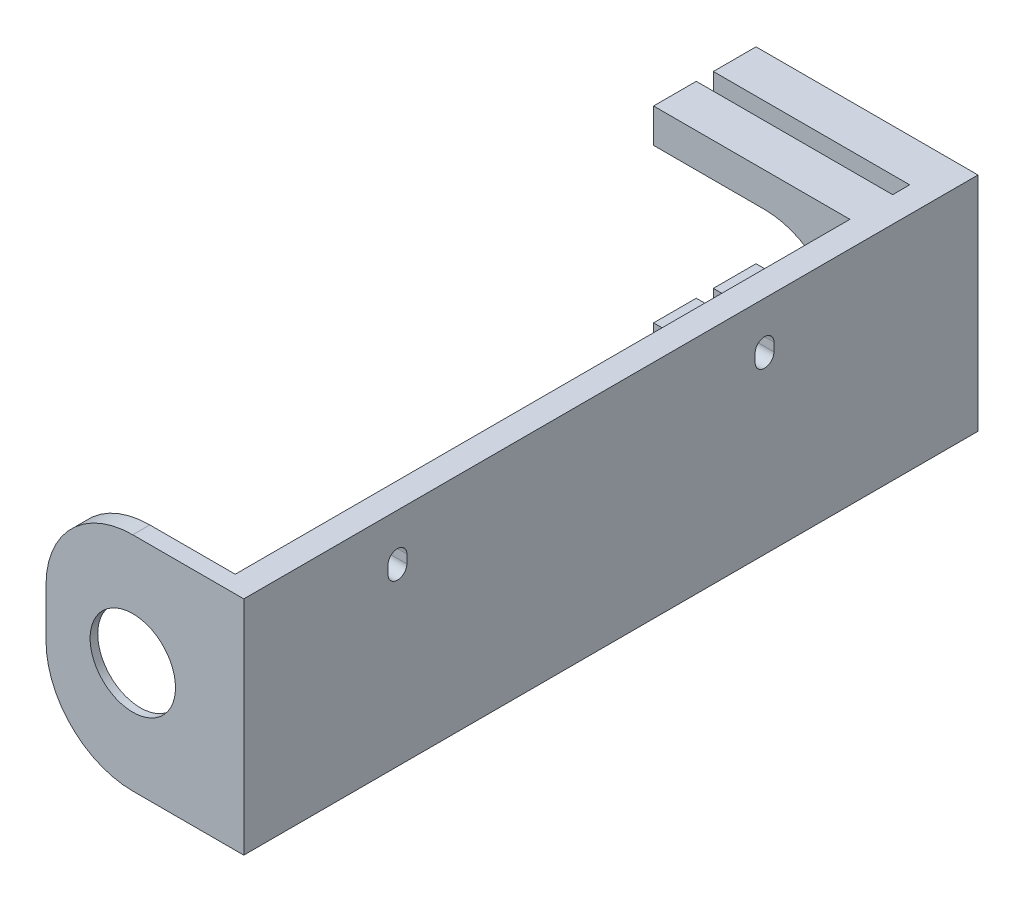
SolidWorks part; units mm, degrees
other "<needle-holder_up>-<SurfaceCut1>"
other "<needle-holder_down>-<Boss-Extrude15>"
ref_plane "Front Plane" through (0, 0, 0) normal (0, 0, 1) x (1, 0, 0)
ref_plane "Top Plane" through (0, 0, 0) normal (0, 1, 0) x (1, 0, 0)
ref_plane "Right Plane" through (0, 0, 0) normal (1, 0, 0) x (0, 0, -1)
ref_plane "前视基准面-needle-holder_up" through (-23.7853, -14.7077, 22.5434) normal (0, 0, 1) x (1, 0, 0)
ref_plane "上视基准面-needle-holder_up" through (-23.7853, -14.7077, 22.5434) normal (0, 1, 0) x (1, 0, 0)
ref_plane "右视基准面-needle-holder_up" through (-23.7853, -14.7077, 22.5434) normal (1, 0, 0) x (0, 0, -1)
sketch "草图1-needle-holder_up" plane through (-23.7853, -14.7077, 22.5434) normal (1, 0, 0) x (0, 0, -1)
  line L5 (0, 0) -> (28, 0)
  line L6 (0, 0) -> (0, 20)
  line L7 (0, 20) -> (28, 20)
  line L8 (28, 0) -> (28, 20)
  dimension "D1" = 28
  dimension "D2" = 20
ref_plane "前视基准面-needle-syringeholder-needle-holder_up" through (-51.5805, 52.3774, -5.4566) normal (0, -1, 0) x (1, 0, 0)
ref_plane "上视基准面-needle-syringeholder-needle-holder_up" through (-51.5805, 52.3774, -5.4566) normal (0, 0, 1) x (1, 0, 0)
ref_plane "右视基准面-needle-syringeholder-needle-holder_up" through (-51.5805, 52.3774, -5.4566) normal (1, 0, 0) x (0, 1, 0)
sketch "草图1-needle-syringeholder-needle-holder_up" plane through (-51.5805, 52.3774, -5.4566) normal (0, -1, 0) x (1, 0, 0)
  line L1 (0, 0) -> (20, 0)
  line L2 (0, 0) -> (0, -12)
  line L3 (0, -12) -> (20, -12)
  line L4 (20, 0) -> (20, -12)
  dimension "D1" = 20
  dimension "D2" = 12
sketch "草图2-needle-syringeholder-needle-holder_up" plane through (-51.5805, 52.3774, -5.4566) normal (-1, 0, 0) x (0, -1, 0)
  line L1 (4, -5) -> (25, -5)
  line L2 (4, -5) -> (4, -7)
  line L3 (4, -7) -> (25, -7)
  line L4 (25, -5) -> (25, -7)
  dimension "D1" = 2
  dimension "D2" = 21
sketch "草图3-needle-syringeholder-needle-holder_up" plane through (-51.5805, 52.3774, -17.4566) normal (0, 0, -1) x (-1, 0, 0)
  circle A0 centre (-10, -14.7) radius 8.7
  dimension "D1" = 17.4
sketch "草图4-needle-syringeholder-needle-holder_up" plane through (-51.5805, 52.3774, -17.4566) normal (0, 0, -1) x (1, 0, 0)
  line L1 (1.3, 14.7) -> (18.7, 14.7)
  line L2 (1.3, 14.7) -> (1.3, 25)
  line L3 (1.3, 25) -> (18.7, 25)
  line L4 (18.7, 14.7) -> (18.7, 25)
  dimension "D1" = 17.4
sketch "草图5-needle-syringeholder-needle-holder_up" plane through (-51.5805, 52.3774, -5.4566) normal (0, 0, 1) x (1, 0, 0)
  circle A0 centre (10, -14.7) radius 7.5
  dimension "D1" = 15
sketch "草图6-needle-syringeholder-needle-holder_up" plane through (-51.5805, 52.3774, -5.4566) normal (0, 0, 1) x (1, 0, 0)
  line L1 (2.5, -14.7) -> (17.5, -14.7)
  line L2 (2.5, -14.7) -> (2.5, -25)
  line L3 (2.5, -25) -> (17.5, -25)
  line L4 (17.5, -14.7) -> (17.5, -25)
  dimension "D1" = 15
sketch "Sketch8-needle-holder_up" plane through (-23.7853, -14.7077, -17.4566) normal (0, 0, -1) x (-1, 0, 0)
  line L0 (3, 10) -> (-3, 10)
  point P0 (3, 10)
sketch "Sketch9-needle-holder_up" plane through (-20.7853, -14.7077, 22.5434) normal (1, 0, 0) x (0, 0, -1)
  line L0 (40, 10) -> (0, 10)
  point P0 (40, 10)
sketch "Sketch11-needle-holder_up" plane through (-45.7853, -14.7077, 22.5434) normal (-1, 0, 0) x (0, 0, 1)
  line L16 (-35, 1.3) -> (-40, 1.3)
  line L17 (-40, 1.3) -> (-40, 0)
  line L18 (-40, 0) -> (-35, 0)
  line L19 (-35, 0) -> (-35, 1.3)
  line L20 (-28, 2.5) -> (-33, 2.5)
  line L21 (-33, 2.5) -> (-33, 0)
  line L22 (-33, 0) -> (-28, 0)
  line L23 (-28, 0) -> (-28, 2.5)
  line L24 (-33, 17.5) -> (-28, 17.5)
  line L25 (-28, 17.5) -> (-28, 20)
  line L26 (-28, 20) -> (-33, 20)
  line L27 (-33, 20) -> (-33, 17.5)
  line L28 (-40, 18.7) -> (-35, 18.7)
  line L29 (-35, 18.7) -> (-35, 20)
  line L30 (-35, 20) -> (-40, 20)
  line L31 (-40, 20) -> (-40, 18.7)
sketch "Sketch13-needle-holder_up" plane through (-23.7853, -14.7077, 22.5434) normal (0, -1, 0) x (1, 0, 0)
  line L0 (0, -28) -> (0, -40)
  line L3 (-1, -33) -> (0, -33)
  line L4 (-1, -33) -> (-1, -35)
  line L5 (-1, -35) -> (0, -35)
  line L6 (0, -33) -> (0, -35)
ref_plane "Plane1-needle-holder_up" through (-20.7853, 5.2923, 22.5434) normal (-1, 0, 0) x (0, 0, 1)
sketch "Sketch17-needle-holder_up" plane through (-23.7853, -14.7077, -5.4566) normal (0, 0, 1) x (1, 0, 0)
  line L2 (-10, 19) -> (-22, 19)
  line L3 (-10, 19) -> (-10, 1)
  line L4 (-10, 1) -> (-22, 1)
  line L5 (-22, 19) -> (-22, 1)
  circle A0 centre (-10, 10) radius 9
  dimension "D1" = 18
sketch "Sketch19-needle-holder_up" plane through (-23.7853, -14.7077, -5.4566) normal (0, 0, 1) x (1, 0, 0)
  line L1 (-22, 20) -> (0, 20)
  line L2 (-22, 20) -> (-22, 21)
  line L3 (-22, 21) -> (0, 21)
  line L4 (0, 20) -> (0, 21)
  line L5 (-22, 0) -> (0, 0)
  line L6 (-22, 0) -> (-22, -1)
  line L7 (-22, -1) -> (0, -1)
  line L8 (0, 0) -> (0, -1)
  line L11 (0, 0) -> (0, 20)
  line L13 (0, 21) -> (3, 21)
  line L14 (0, 21) -> (0, 20)
  line L15 (0, 20) -> (3, 20)
  line L16 (3, 21) -> (3, 20)
  line L17 (0, 0) -> (3, 0)
  line L18 (0, 0) -> (0, -1)
  line L19 (0, -1) -> (3, -1)
  line L20 (3, 0) -> (3, -1)
  dimension "D1" = 1
  dimension "D2" = 1
sketch "Sketch18-needle-holder_up" plane through (-23.7853, -14.7077, -5.4566) normal (0, 0, 1) x (1, 0, 0)
  line L1 (-21, 19) -> (-19, 19)
  line L2 (-21, 19) -> (-21, 1)
  line L3 (-21, 1) -> (-19, 1)
  line L4 (-19, 19) -> (-19, 1)
  line L6 (-21, 19) -> (-21.5, 20)
  line L7 (-21.5, 20) -> (-18.5, 20)
  line L8 (-18.5, 20) -> (-19, 19)
  line L9 (-3, 10) -> (-21, 10)
  line L10 (-18.5, 0) -> (-19, 1)
  line L11 (-21, 1) -> (-21.5, 0)
  line L12 (-21.5, 0) -> (-18.5, 0)
  dimension "D3" = 2
  dimension "D4" = 3
  dimension "D5" = 1
sketch "Sketch20-needle-holder_up" plane through (-45.7853, -14.7077, 22.5434) normal (-1, 0, 0) x (0, 0, 1)
  line L16 (-35, -1) -> (-35, 1)
  line L17 (-35, 1) -> (-40, 1)
  line L18 (-40, 1) -> (-40, -1)
  line L19 (-40, -1) -> (-35, -1)
  line L20 (-28, -1) -> (-28, 1)
  line L21 (-28, 1) -> (-33, 1)
  line L22 (-33, 1) -> (-33, -1)
  line L23 (-33, -1) -> (-28, -1)
  line L24 (-33, 19) -> (-28, 19)
  line L25 (-28, 19) -> (-28, 21)
  line L26 (-28, 21) -> (-33, 21)
  line L27 (-33, 21) -> (-33, 19)
  line L28 (-40, 19) -> (-35, 19)
  line L29 (-35, 19) -> (-35, 21)
  line L30 (-35, 21) -> (-40, 21)
  line L31 (-40, 21) -> (-40, 19)
sketch "Sketch23-needle-holder_up" plane through (-23.7853, -14.7077, 22.5434) normal (0, 0, 1) x (1, 0, 0)
  line L8 (0, 21) -> (0, -1)
  line L9 (0, -1) -> (3, -1)
  line L10 (3, -1) -> (3, 21)
  line L11 (3, 21) -> (0, 21)
sketch "Sketch28-needle-holder_up" plane through (-23.7853, -14.7077, 22.5434) normal (-1, 0, 0) x (0, 0, 1)
  line L1 (39, 21) -> (35, 21)
  line L2 (39, 21) -> (39, -1)
  line L3 (39, -1) -> (35, -1)
  line L4 (35, 21) -> (35, -1)
  dimension "D1" = 4
ref_plane "Front Plane-syringe10ml-cylinder-needle-holder_up" through (-33.7853, -4.7077, -62.8005) normal (-1, 0, 0) x (0, 0, 1)
ref_plane "Top Plane-syringe10ml-cylinder-needle-holder_up" through (-33.7853, -4.7077, -62.8005) normal (0, 1, 0) x (0, 0, 1)
ref_plane "Right Plane-syringe10ml-cylinder-needle-holder_up" through (-33.7853, -4.7077, -62.8005) normal (0, 0, 1) x (1, 0, 0)
sketch "Sketch1-syringe10ml-cylinder-needle-holder_up" plane through (-33.7853, -4.7077, -62.8005) normal (-1, 0, 0) x (0, 0, 1)
  line L0 (103.5215, 0) -> (-103.5215, 0) construction
  line L1 (0, 7.3) -> (0, 12)
  line L2 (0, 12) -> (1.8, 12)
  line L3 (1.8, 12) -> (1.8, 8.5)
  line L4 (1.8, 8.5) -> (71.75, 8.5)
  line L5 (71.75, 8.5) -> (73.2229, 4.7)
  line L10 (74.25, 2.05) -> (84, 2.05)
  line L11 (84, 2.05) -> (84, 0.95)
  line L12 (84, 0.95) -> (73.5388, 0.95)
  line L13 (73.5388, 0.95) -> (71, 7.5)
  line L14 (71, 7.5) -> (5, 7.5)
  line L15 (5, 7.5) -> (5, 7.3)
  line L16 (5, 7.3) -> (0, 7.3)
  line L17 (73.2229, 4.7) -> (81.2229, 4.7)
  line L18 (81.2229, 4.7) -> (81.2229, 3.5)
  line L19 (81.2229, 3.5) -> (73.688, 3.5)
  line L20 (73.688, 3.5) -> (74.25, 2.05)
  point P4 (0, 0)
  dimension "D1" = 24
  dimension "D2" = 17
  dimension "D3" = 15
  dimension "D4" = 14.6
  dimension "D5" = 5
  dimension "D6" = 1.8
  dimension "D7" = 84
  dimension "D8" = 9.75
  dimension "D9" = 71.75
  dimension "D10" = 111.186
  dimension "D11" = 9.4
  dimension "D12" = 4.1
  dimension "D13" = 1.9
  dimension "D14" = 7
  dimension "D15" = 71
  dimension "D16" = 8
sketch "Sketch9-syringe10ml-cylinder-needle-holder_up" plane through (-33.7853, -4.7077, -61.0005) normal (0, 0, 1) x (1, 0, 0)
  line L5 (1.25, -12) -> (1.75, -12)
  line L6 (-0.25, -12) -> (0.25, -12)
  line L2306 (-0.25, -12) -> (-0.25, 12)
  line L2307 (-0.25, 12) -> (0.25, 12)
  line L2308 (0.25, -12) -> (0.25, 12)
  line L2309 (-0.25, -12) -> (0.25, 12) construction
  line L2310 (-0.25, 12) -> (0.25, -12) construction
  line L2311 (1.75, -12) -> (1.75, 12)
  line L2312 (1.25, 12) -> (1.75, 12)
  line L2313 (1.25, -12) -> (1.25, 12)
  line L2314 (2.75, -12) -> (3.25, -12)
  line L2315 (3.25, -12) -> (3.25, 12)
  line L2316 (2.75, 12) -> (3.25, 12)
  line L2317 (2.75, -12) -> (2.75, 12)
  line L2318 (4.25, -12) -> (4.75, -12)
  line L2319 (4.75, -12) -> (4.75, 12)
  line L2320 (4.25, 12) -> (4.75, 12)
  line L2321 (4.25, -12) -> (4.25, 12)
  line L2322 (5.75, -12) -> (6.25, -12)
  line L2323 (6.25, -12) -> (6.25, 12)
  line L2324 (5.75, 12) -> (6.25, 12)
  line L2325 (5.75, -12) -> (5.75, 12)
  line L2326 (7.25, -12) -> (7.75, -12)
  line L2327 (7.75, -12) -> (7.75, 12)
  line L2328 (7.25, 12) -> (7.75, 12)
  line L2329 (7.25, -12) -> (7.25, 12)
  line L2330 (8.75, -12) -> (9.25, -12)
  line L2331 (9.25, -12) -> (9.25, 12)
  line L2332 (8.75, 12) -> (9.25, 12)
  line L2333 (8.75, -12) -> (8.75, 12)
  line L2334 (10.25, -12) -> (10.75, -12)
  line L2335 (10.75, -12) -> (10.75, 12)
  line L2336 (10.25, 12) -> (10.75, 12)
  line L2337 (10.25, -12) -> (10.25, 12)
  line L2338 (11.75, -12) -> (12.25, -12)
  line L2339 (12.25, -12) -> (12.25, 12)
  line L2340 (11.75, 12) -> (12.25, 12)
  line L2341 (11.75, -12) -> (11.75, 12)
  line L2342 (13.25, -12) -> (13.75, -12)
  line L2343 (13.75, -12) -> (13.75, 12)
  line L2344 (13.25, 12) -> (13.75, 12)
  line L2345 (13.25, -12) -> (13.25, 12)
  line L2346 (14.75, -12) -> (15.25, -12)
  line L2347 (15.25, -12) -> (15.25, 12)
  line L2348 (14.75, 12) -> (15.25, 12)
  line L2349 (14.75, -12) -> (14.75, 12)
  line L2350 (16.25, -12) -> (16.75, -12)
  line L2351 (16.75, -12) -> (16.75, 12)
  line L2352 (16.25, 12) -> (16.75, 12)
  line L2353 (16.25, -12) -> (16.25, 12)
  line L2354 (17.75, -12) -> (18.25, -12)
  line L2355 (18.25, -12) -> (18.25, 12)
  line L2356 (17.75, 12) -> (18.25, 12)
  line L2357 (17.75, -12) -> (17.75, 12)
  line L2358 (19.25, -12) -> (19.75, -12)
  line L2359 (19.75, -12) -> (19.75, 12)
  line L2360 (19.25, 12) -> (19.75, 12)
  line L2361 (19.25, -12) -> (19.25, 12)
  line L2362 (20.75, -12) -> (21.25, -12)
  line L2363 (21.25, -12) -> (21.25, 12)
  line L2364 (20.75, 12) -> (21.25, 12)
  line L2365 (20.75, -12) -> (20.75, 12)
  line L2366 (22.25, -12) -> (22.75, -12)
  line L2367 (22.75, -12) -> (22.75, 12)
  line L2368 (22.25, 12) -> (22.75, 12)
  line L2369 (22.25, -12) -> (22.25, 12)
  line L2370 (-1.75, -12) -> (-1.25, -12)
  line L2371 (-1.25, -12) -> (-1.25, 12)
  line L2372 (-1.75, 12) -> (-1.25, 12)
  line L2373 (-1.75, -12) -> (-1.75, 12)
  line L2374 (-3.25, -12) -> (-2.75, -12)
  line L2375 (-2.75, -12) -> (-2.75, 12)
  line L2376 (-3.25, 12) -> (-2.75, 12)
  line L2377 (-3.25, -12) -> (-3.25, 12)
  line L2378 (-4.75, -12) -> (-4.25, -12)
  line L2379 (-4.25, -12) -> (-4.25, 12)
  line L2380 (-4.75, 12) -> (-4.25, 12)
  line L2381 (-4.75, -12) -> (-4.75, 12)
  line L2382 (-6.25, -12) -> (-5.75, -12)
  line L2383 (-5.75, -12) -> (-5.75, 12)
  line L2384 (-6.25, 12) -> (-5.75, 12)
  line L2385 (-6.25, -12) -> (-6.25, 12)
  line L2386 (-7.75, -12) -> (-7.25, -12)
  line L2387 (-7.25, -12) -> (-7.25, 12)
  line L2388 (-7.75, 12) -> (-7.25, 12)
  line L2389 (-7.75, -12) -> (-7.75, 12)
  line L2390 (-9.25, -12) -> (-8.75, -12)
  line L2391 (-8.75, -12) -> (-8.75, 12)
  line L2392 (-9.25, 12) -> (-8.75, 12)
  line L2393 (-9.25, -12) -> (-9.25, 12)
  line L2394 (-10.75, -12) -> (-10.25, -12)
  line L2395 (-10.25, -12) -> (-10.25, 12)
  line L2396 (-10.75, 12) -> (-10.25, 12)
  line L2397 (-10.75, -12) -> (-10.75, 12)
  line L2398 (-12.25, -12) -> (-11.75, -12)
  line L2399 (-11.75, -12) -> (-11.75, 12)
  line L2400 (-12.25, 12) -> (-11.75, 12)
  line L2401 (-12.25, -12) -> (-12.25, 12)
  line L2402 (-13.75, -12) -> (-13.25, -12)
  line L2403 (-13.25, -12) -> (-13.25, 12)
  line L2404 (-13.75, 12) -> (-13.25, 12)
  line L2405 (-13.75, -12) -> (-13.75, 12)
  line L2406 (-15.25, -12) -> (-14.75, -12)
  line L2407 (-14.75, -12) -> (-14.75, 12)
  line L2408 (-15.25, 12) -> (-14.75, 12)
  line L2409 (-15.25, -12) -> (-15.25, 12)
  line L2410 (-16.75, -12) -> (-16.25, -12)
  line L2411 (-16.25, -12) -> (-16.25, 12)
  line L2412 (-16.75, 12) -> (-16.25, 12)
  line L2413 (-16.75, -12) -> (-16.75, 12)
  line L2414 (-18.25, -12) -> (-17.75, -12)
  line L2415 (-17.75, -12) -> (-17.75, 12)
  line L2416 (-18.25, 12) -> (-17.75, 12)
  line L2417 (-18.25, -12) -> (-18.25, 12)
  line L2418 (-19.75, -12) -> (-19.25, -12)
  line L2419 (-19.25, -12) -> (-19.25, 12)
  line L2420 (-19.75, 12) -> (-19.25, 12)
  line L2421 (-19.75, -12) -> (-19.75, 12)
  line L2422 (-21.25, -12) -> (-20.75, -12)
  line L2423 (-20.75, -12) -> (-20.75, 12)
  line L2424 (-21.25, 12) -> (-20.75, 12)
  line L2425 (-21.25, -12) -> (-21.25, 12)
  line L2426 (-22.75, -12) -> (-22.25, -12)
  line L2427 (-22.25, -12) -> (-22.25, 12)
  line L2428 (-22.75, 12) -> (-22.25, 12)
  line L2429 (-22.75, -12) -> (-22.75, 12)
  point P0 (0, 0)
  dimension "D1" = 0.5
  dimension "D2" = 16
  dimension "D3" = 16
sketch "Sketch7-syringe10ml-cylinder-needle-holder_up" plane through (-33.7853, -4.7077, -62.8005) normal (0, 0, -1) x (-1, 0, 0)
  line L0 (0, 22.4439) -> (0, -22.4439) construction
  line L1 (14.7478, 0) -> (-14.7478, 0) construction
  line L2 (-8.6269, -5.0574) -> (-5.9507, -9.6223)
  line L3 (-8.6269, 5.0574) -> (-5.9507, 9.6223)
  line L4 (8.6269, 5.0574) -> (5.9507, 9.6223)
  line L5 (8.6269, -5.0574) -> (5.9507, -9.6223)
  arc A1 (-3.75, -11.399) -> (3.75, -11.399) centre (0, 0) ccw
  arc A2 (8.6269, -5.0574) -> (8.6269, 5.0574) centre (0, 0) ccw
  arc A3 (-5.9507, -9.6223) -> (-3.75, -11.399) centre (-2.5, -7.5993) ccw
  arc A4 (-5.9507, 9.6223) -> (-3.75, 11.399) centre (-2.5, 7.5993) cw
  arc A5 (5.9507, 9.6223) -> (3.75, 11.399) centre (2.5, 7.5993) ccw
  arc A6 (5.9507, -9.6223) -> (3.75, -11.399) centre (2.5, -7.5993) cw
  arc A7 (3.75, 11.399) -> (-3.75, 11.399) centre (0, 0) ccw
  arc A8 (-8.6269, 5.0574) -> (-8.6269, -5.0574) centre (0, 0) ccw
  point P6 (0, 0)
  point P9 (0, 0)
  dimension "D1" = 4
  dimension "D2" = 5
  dimension "D3" = 10
sketch "Sketch8-syringe10ml-cylinder-needle-holder_up" plane through (-33.7853, -4.7077, -62.8005) normal (-1, 0, 0) x (0, 0, 1)
  line L0 (0, 0) -> (147.0884, 0) construction
  line L2 (70.75, 3) -> (71, 3)
  line L3 (70.75, 3) -> (70.75, -3)
  line L4 (70.75, -3) -> (71, -3)
  line L5 (71, 3) -> (71, -3)
  line L6 (70.75, 3) -> (71, -3) construction
  line L7 (70.75, -3) -> (71, 3) construction
  line L8 (59.45, 3) -> (59.45, -3)
  line L9 (59.45, -3) -> (59.7, -3)
  line L10 (59.7, 3) -> (59.7, -3)
  line L11 (59.45, 3) -> (59.7, 3)
  line L12 (48.15, 3) -> (48.15, -3)
  line L13 (48.15, -3) -> (48.4, -3)
  line L14 (48.4, 3) -> (48.4, -3)
  line L15 (48.15, 3) -> (48.4, 3)
  line L16 (36.85, 3) -> (36.85, -3)
  line L17 (36.85, -3) -> (37.1, -3)
  line L18 (37.1, 3) -> (37.1, -3)
  line L19 (36.85, 3) -> (37.1, 3)
  line L20 (25.55, 3) -> (25.55, -3)
  line L21 (25.55, -3) -> (25.8, -3)
  line L22 (25.8, 3) -> (25.8, -3)
  line L23 (25.55, 3) -> (25.8, 3)
  line L32 (66.23, 1.5) -> (66.23, -1.5)
  line L33 (68.49, 1.5) -> (68.74, 1.5)
  line L34 (68.49, 1.5) -> (68.49, -1.5)
  line L35 (68.49, -1.5) -> (68.74, -1.5)
  line L36 (68.74, 1.5) -> (68.74, -1.5)
  line L37 (68.49, 1.5) -> (68.74, -1.5) construction
  line L38 (68.49, -1.5) -> (68.74, 1.5) construction
  line L39 (66.23, -1.5) -> (66.48, -1.5)
  line L40 (66.48, 1.5) -> (66.48, -1.5)
  line L41 (66.23, 1.5) -> (66.48, 1.5)
  line L42 (63.97, 1.5) -> (63.97, -1.5)
  line L43 (63.97, -1.5) -> (64.22, -1.5)
  line L44 (64.22, 1.5) -> (64.22, -1.5)
  line L45 (63.97, 1.5) -> (64.22, 1.5)
  line L46 (61.71, 1.5) -> (61.71, -1.5)
  line L47 (61.71, -1.5) -> (61.96, -1.5)
  line L48 (61.96, 1.5) -> (61.96, -1.5)
  line L49 (61.71, 1.5) -> (61.96, 1.5)
  line L50 (59.45, 1.5) -> (59.45, -1.5)
  line L51 (59.45, -1.5) -> (59.7, -1.5)
  line L52 (59.7, 1.5) -> (59.7, -1.5)
  line L53 (59.45, 1.5) -> (59.7, 1.5)
  line L54 (57.19, 1.5) -> (57.19, -1.5)
  line L55 (57.19, -1.5) -> (57.44, -1.5)
  line L56 (57.44, 1.5) -> (57.44, -1.5)
  line L57 (57.19, 1.5) -> (57.44, 1.5)
  line L58 (54.93, 1.5) -> (54.93, -1.5)
  line L59 (54.93, -1.5) -> (55.18, -1.5)
  line L60 (55.18, 1.5) -> (55.18, -1.5)
  line L61 (54.93, 1.5) -> (55.18, 1.5)
  line L62 (52.67, 1.5) -> (52.67, -1.5)
  line L63 (52.67, -1.5) -> (52.92, -1.5)
  line L64 (52.92, 1.5) -> (52.92, -1.5)
  line L65 (52.67, 1.5) -> (52.92, 1.5)
  line L66 (50.41, 1.5) -> (50.41, -1.5)
  line L67 (50.41, -1.5) -> (50.66, -1.5)
  line L68 (50.66, 1.5) -> (50.66, -1.5)
  line L69 (50.41, 1.5) -> (50.66, 1.5)
  line L70 (48.15, 1.5) -> (48.15, -1.5)
  line L71 (48.15, -1.5) -> (48.4, -1.5)
  line L72 (48.4, 1.5) -> (48.4, -1.5)
  line L73 (48.15, 1.5) -> (48.4, 1.5)
  line L74 (45.89, 1.5) -> (45.89, -1.5)
  line L75 (45.89, -1.5) -> (46.14, -1.5)
  line L76 (46.14, 1.5) -> (46.14, -1.5)
  line L77 (45.89, 1.5) -> (46.14, 1.5)
  line L78 (43.63, 1.5) -> (43.63, -1.5)
  line L79 (43.63, -1.5) -> (43.88, -1.5)
  line L80 (43.88, 1.5) -> (43.88, -1.5)
  line L81 (43.63, 1.5) -> (43.88, 1.5)
  line L82 (41.37, 1.5) -> (41.37, -1.5)
  line L83 (41.37, -1.5) -> (41.62, -1.5)
  line L84 (41.62, 1.5) -> (41.62, -1.5)
  line L85 (41.37, 1.5) -> (41.62, 1.5)
  line L86 (39.11, 1.5) -> (39.11, -1.5)
  line L87 (39.11, -1.5) -> (39.36, -1.5)
  line L88 (39.36, 1.5) -> (39.36, -1.5)
  line L89 (39.11, 1.5) -> (39.36, 1.5)
  line L90 (36.85, 1.5) -> (36.85, -1.5)
  line L91 (36.85, -1.5) -> (37.1, -1.5)
  line L92 (37.1, 1.5) -> (37.1, -1.5)
  line L93 (36.85, 1.5) -> (37.1, 1.5)
  line L94 (34.59, 1.5) -> (34.59, -1.5)
  line L95 (34.59, -1.5) -> (34.84, -1.5)
  line L96 (34.84, 1.5) -> (34.84, -1.5)
  line L97 (34.59, 1.5) -> (34.84, 1.5)
  line L98 (32.33, 1.5) -> (32.33, -1.5)
  line L99 (32.33, -1.5) -> (32.58, -1.5)
  line L100 (32.58, 1.5) -> (32.58, -1.5)
  line L101 (32.33, 1.5) -> (32.58, 1.5)
  line L102 (30.07, 1.5) -> (30.07, -1.5)
  line L103 (30.07, -1.5) -> (30.32, -1.5)
  line L104 (30.32, 1.5) -> (30.32, -1.5)
  line L105 (30.07, 1.5) -> (30.32, 1.5)
  line L106 (27.81, 1.5) -> (27.81, -1.5)
  line L107 (27.81, -1.5) -> (28.06, -1.5)
  line L108 (28.06, 1.5) -> (28.06, -1.5)
  line L109 (27.81, 1.5) -> (28.06, 1.5)
  line L110 (25.55, 1.5) -> (25.55, -1.5)
  line L111 (25.55, -1.5) -> (25.8, -1.5)
  line L112 (25.8, 1.5) -> (25.8, -1.5)
  line L113 (25.55, 1.5) -> (25.8, 1.5)
  line L130 (13, -3) -> (13, -8) construction
  line L131 (23.29, 1.5) -> (23.29, -1.5)
  line L132 (23.29, -1.5) -> (23.54, -1.5)
  line L133 (23.54, 1.5) -> (23.54, -1.5)
  line L150 (23.29, 1.5) -> (23.54, 1.5)
  line L151 (21.03, 1.5) -> (21.03, -1.5)
  line L152 (21.03, -1.5) -> (21.28, -1.5)
  line L153 (21.28, 1.5) -> (21.28, -1.5)
  line L154 (58.2, 3) -> (58.2, 8) construction
  line L155 (46.9, 3) -> (46.9, 8) construction
  line L156 (35.6, 3) -> (35.6, 8) construction
  line L157 (24.3, 3) -> (24.3, 8) construction
  line L158 (21.03, 1.5) -> (21.28, 1.5)
  line L159 (18.77, 1.5) -> (18.77, -1.5)
  line L160 (18.77, -1.5) -> (19.02, -1.5)
  line L161 (19.02, 1.5) -> (19.02, -1.5)
  line L162 (18.77, 1.5) -> (19.02, 1.5)
  line L163 (16.51, 1.5) -> (16.51, -1.5)
  line L164 (16.51, -1.5) -> (16.76, -1.5)
  line L165 (16.76, 1.5) -> (16.76, -1.5)
  line L166 (16.51, 1.5) -> (16.76, 1.5)
  line L171 (13, 3) -> (13, 8) construction
  line L172 (14.25, 3) -> (14.25, -3)
  line L173 (14.25, -3) -> (14.5, -3)
  line L174 (14.5, 3) -> (14.5, -3)
  line L175 (14.25, 3) -> (14.5, 3)
  line L176 (14.25, 1.5) -> (14.5, 1.5)
  line L177 (14.25, 1.5) -> (14.25, -1.5)
  line L178 (14.25, -1.5) -> (14.5, -1.5)
  line L179 (14.5, 1.5) -> (14.5, -1.5)
  text T0 "2" font "Century Gothic" height 2.5
  text T1 "4" font "Century Gothic" height 2.5
  text T2 "6" font "Century Gothic" height 2.5
  text T3 "8" font "Century Gothic" height 2.5
  text T4 "ml" font "Century Gothic" height 2.5
  text T5 "10" font "Century Gothic" height 2.5
  point P3 (70.875, 0)
  point P10 (68.615, 0)
  dimension "D1" = 0.25
  dimension "D2" = 6
  dimension "D4" = 3
  dimension "D5" = 2.26
  dimension "D7" = 2.26
  dimension "D8" = 11.3
  dimension "D9" = 5
  dimension "D11" = 1.5
  dimension "D12" = 1.5
  dimension "D3" = 6
  dimension "D6" = 25
  dimension "D10" = 5
sketch "Sketch34-needle-holder_up" plane through (-23.7853, -14.7077, 57.5434) normal (0, 0, -1) x (-1, 0, 0)
  circle A0 centre (10, 10) radius 8.75
  dimension "D1" = 17.5
sketch "Sketch35-needle-holder_up" plane through (-23.7853, -14.7077, 57.5434) normal (0, 0, -1) x (-1, 0, 0)
  circle A0 centre (10, 10) radius 5
  dimension "D1" = 10
sketch "Sketch21-needle-holder_up" plane through (-20.7853, -14.7077, 22.5434) normal (1, 0, 0) x (0, 0, -1)
  line L0 (0.5, 21) -> (0.5, -1) construction
  line L2 (-21, 18) -> (-21, 17) construction
  line L12 (-19.9, 18) -> (-19.9, 17)
  line L15 (-22.1, 18) -> (-22.1, 17)
  line L16 (22, 18) -> (22, 17) construction
  line L17 (20.9, 18) -> (20.9, 17)
  line L18 (23.1, 18) -> (23.1, 17)
  arc A10 (-19.9, 18) -> (-22.1, 18) centre (-21, 18) ccw
  arc A11 (-22.1, 17) -> (-19.9, 17) centre (-21, 17) ccw
  arc A12 (20.9, 18) -> (23.1, 18) centre (22, 18) cw
  arc A13 (23.1, 17) -> (20.9, 17) centre (22, 17) cw
  point P4 (-21, 17.5)
  point P12 (22, 17.5)
  dimension "D1" = 1.1
  dimension "D2" = 1
sketch "Sketch36-needle-holder_up" plane through (-23.7853, -14.7077, 22.5434) normal (-1, 0, 0) x (0, 0, 1)
  circle A0 centre (6.6018, 6.2809) radius 1.6
  dimension "D1" = 3.2
sketch "Sketch37-needle-holder_up" plane through (-20.7853, -14.7077, 22.5434) normal (1, 0, 0) x (0, 0, -1)
  line L1 (-37, 1.25) -> (-37, 18.75)
  line L2 (-37, 18.75) -> (-37, 21)
  line L4 (-37, 21) -> (-28, 21)
  line L5 (-28, 21) -> (-28, -1)
  line L7 (-28, -1) -> (-37, -1)
  line L8 (-37, -1) -> (-37, 1.25)
  dimension "D1" = 9
sketch "Sketch39-needle-holder_up" plane through (-23.7853, -14.7077, 22.5434) normal (-1, 0, 0) x (0, 0, 1)
  line L1 (-23.0764, 8.0309) -> (31.9236, 8.0309)
  line L2 (-23.0764, 8.0309) -> (-23.0764, 4.5309)
  line L3 (-23.0764, 4.5309) -> (31.9236, 4.5309)
  line L4 (31.9236, 8.0309) -> (31.9236, 4.5309)
  point P4 (6.6018, 6.2809)
  point P5 (-23.0764, 6.2809)
  dimension "D1" = 55
  dimension "D2" = 3.5
sketch "Sketch40-needle-holder_up" plane through (-23.7853, -15.7077, 22.5434) normal (0, -1, 0) x (1, 0, 0)
  line L24 (-10, 39) -> (-10, 37)
  line L25 (-10, 37) -> (0, 37)
  line L26 (0, 37) -> (0, -28)
  line L27 (0, -28) -> (-23, -28)
  line L28 (-23, -28) -> (-23, -33)
  line L29 (-23, -33) -> (0, -33)
  line L30 (0, -33) -> (0, -35)
  line L31 (0, -35) -> (-23, -35)
  line L32 (-23, -35) -> (-23, -40)
  line L33 (-23, -40) -> (3, -40)
  line L34 (3, -40) -> (3, 39)
  line L35 (3, 39) -> (-10, 39)
sketch "Sketch42-needle-holder_up" plane through (-23.7853, -14.7077, 61.5434) normal (0, 0, 1) x (1, 0, 0)
  line L0 (-20.1667, 7.1667) -> (-20.1667, 12.8333)
  line L12 (-20, 11) -> (-20, 9)
  line L13 (-10, -1) -> (-10, -3)
  line L14 (-10, -3) -> (3, -3)
  line L15 (3, -3) -> (3, 23)
  line L16 (3, 23) -> (-10, 23)
  line L17 (-10, 23) -> (-10, 21)
  arc A0 (-10, 23) -> (-20, 11) centre (-10, 12.8333) ccw
  arc A1 (-10, -3) -> (-20, 9) centre (-10, 7.1667) cw
  arc A4 (-20, 9) -> (-10, -1) centre (-10, 9) ccw
  arc A5 (-10, 21) -> (-20, 11) centre (-10, 11) ccw
ref_plane "Plane2-needle-holder_up" through (-23.7853, -14.7077, -5.4566) normal (0, 0, 1) x (1, 0, 0)
inserted part "needle-holder_up" parameters "D1.凸台-拉伸2"=3, "D1.草图1"=28, "D2.草图1"=20, "D1.凸台-拉伸1.needle-syringeholder"=25, "D1.草图1.needle-syringeholder"=20, "D2.草图1.needle-syringeholder"=12, "D1.草图2.needle-syringeholder"=2, "D2.草图2.needle-syringeholder"=21, "D3.草图2.needle-syringeholder"=5, "D1.草图3.needle-syringeholder"=17.4, "D2.草图3.needle-syringeholder"=10.3, "D3.草图3.needle-syringeholder"=10, "D1.草图4.needle-syringeholder"=17.4, "D1.草图5.needle-syringeholder"=15, "D2.草图5.needle-syringeholder"=10.3, "D3.草图5.needle-syringeholder"=10, "D1.草图6.needle-syringeholder"=15, "D1.Sketch17"=18, "D2.Sketch17"=10, "D1.Sketch19"=1, "D2.Sketch19"=1, "D1.Boss-Extrude4"=1, "D1.Boss-Extrude5"=39, "D1.Sketch23"=0, "D1.Boss-Extrude11"=20, "D1.Sketch28"=4, "D1.Revolve1.syringe10ml-cylinder"=360, "D5.Sketch1.syringe10ml-cylinder"=5, "D6.Sketch1.syringe10ml-cylinder"=1.8, "D7.Sketch1.syringe10ml-cylinder"=84, "D9.Sketch1.syringe10ml-cylinder"=71.75, "D15.Sketch1.syringe10ml-cylinder"=71, "D1.Sketch1.syringe10ml-cylinder"=24, "D2.Sketch1.syringe10ml-cylinder"=17, "D3.Sketch1.syringe10ml-cylinder"=15, "D4.Sketch1.syringe10ml-cylinder"=14.6, "D12.Sketch1.syringe10ml-cylinder"=4.1, "D13.Sketch1.syringe10ml-cylinder"=1.9, "D8.Sketch1.syringe10ml-cylinder"=9.75, "D10.Sketch1.syringe10ml-cylinder"=111.186, "D16.Sketch1.syringe10ml-cylinder"=8, "D11.Sketch1.syringe10ml-cylinder"=9.4, "D14.Sketch1.syringe10ml-cylinder"=7, "D1.Cut-Extrude2.syringe10ml-cylinder"=0.1, "D1.Sketch9.syringe10ml-cylinder"=0.5, "D2.Sketch9.syringe10ml-cylinder"=16, "D3.Sketch9.syringe10ml-cylinder"=16, "D1.Sketch7.syringe10ml-cylinder"=4, "D2.Sketch7.syringe10ml-cylinder"=5, "D3.Sketch7.syringe10ml-cylinder"=10, "D1.Fillet1.syringe10ml-cylinder"=5, "D1.Wrap1.syringe10ml-cylinder"=0.01, "D1.Sketch8.syringe10ml-cylinder"=0.25, "D2.Sketch8.syringe10ml-cylinder"=6, "D3.Sketch8.syringe10ml-cylinder"=6, "D4.Sketch8.syringe10ml-cylinder"=3, "D5.Sketch8.syringe10ml-cylinder"=2.26, "D6.Sketch8.syringe10ml-cylinder"=25, "D7.Sketch8.syringe10ml-cylinder"=2.26, "D8.Sketch8.syringe10ml-cylinder"=11.3, "D9.Sketch8.syringe10ml-cylinder"=5, "D10.Sketch8.syringe10ml-cylinder"=5, "D11.Sketch8.syringe10ml-cylinder"=1.5, "D12.Sketch8.syringe10ml-cylinder"=1.5, "D8.Thread1.syringe10ml-cylinder"=0, "D7.Thread1.syringe10ml-cylinder"=2, "D6.Thread1.syringe10ml-cylinder"=7, "D4.Thread1.syringe10ml-cylinder"=7, "D1.Thread1.syringe10ml-cylinder"=0, "Pitch.Thread Profile1.syringe10ml-cylinder"=1.25, "Profile_Land.Thread Profile1.syringe10ml-cylinder"=0.3125, "Profile_Angle.Thread Profile1.syringe10ml-cylinder"=60, "Profile_Height.Thread Profile1.syringe10ml-cylinder"=0.6766, "D1.Cut-Extrude10"=2, "D1.Sketch34"=17.5, "D1.Cut-Extrude11"=25, "D1.Sketch35"=10, "D1.Cut-Extrude7"=10, "D1.Sketch21"=1.1, "D2.Sketch21"=1, "D1.Fillet1"=10, "D1.Fillet2"=10, "D1.Sketch36"=3.2, "D1.Sketch37"=9, "D1.Boss-Extrude12"=2, "D1.Sketch40"=0, "D1.Boss-Extrude13"=2, "D1.Sketch42"=0
ref_plane "前视基准面-needle-holder_down" through (-82.9443, 5.8429, 37.0413) normal (0, 0, 1) x (1, 0, 0)
ref_plane "上视基准面-needle-holder_down" through (-82.9443, 5.8429, 37.0413) normal (0, 1, 0) x (1, 0, 0)
ref_plane "右视基准面-needle-holder_down" through (-82.9443, 5.8429, 37.0413) normal (1, 0, 0) x (0, 0, -1)
sketch "草图1-needle-holder_down" plane through (-82.9443, 5.8429, 37.0413) normal (1, 0, 0) x (0, 0, -1)
  line L5 (0, 0) -> (28, 0)
  line L6 (0, 0) -> (0, 20)
  line L7 (0, 20) -> (28, 20)
  line L8 (28, 0) -> (28, 20)
  dimension "D1" = 28
  dimension "D2" = 20
ref_plane "前视基准面-needle-syringeholder-needle-holder_down" through (-110.7395, 72.928, 9.0413) normal (0, -1, 0) x (1, 0, 0)
ref_plane "上视基准面-needle-syringeholder-needle-holder_down" through (-110.7395, 72.928, 9.0413) normal (0, 0, 1) x (1, 0, 0)
ref_plane "右视基准面-needle-syringeholder-needle-holder_down" through (-110.7395, 72.928, 9.0413) normal (1, 0, 0) x (0, 1, 0)
sketch "草图1-needle-syringeholder-needle-holder_down" plane through (-110.7395, 72.928, 9.0413) normal (0, -1, 0) x (1, 0, 0)
  line L1 (0, 0) -> (20, 0)
  line L2 (0, 0) -> (0, -12)
  line L3 (0, -12) -> (20, -12)
  line L4 (20, 0) -> (20, -12)
  dimension "D1" = 20
  dimension "D2" = 12
sketch "草图2-needle-syringeholder-needle-holder_down" plane through (-110.7395, 72.928, 9.0413) normal (-1, 0, 0) x (0, -1, 0)
  line L1 (4, -5) -> (25, -5)
  line L2 (4, -5) -> (4, -7)
  line L3 (4, -7) -> (25, -7)
  line L4 (25, -5) -> (25, -7)
  dimension "D1" = 2
  dimension "D2" = 21
sketch "草图3-needle-syringeholder-needle-holder_down" plane through (-110.7395, 72.928, -2.9587) normal (0, 0, -1) x (-1, 0, 0)
  circle A0 centre (-10, -14.7) radius 8.7
  dimension "D1" = 17.4
sketch "草图4-needle-syringeholder-needle-holder_down" plane through (-110.7395, 72.928, -2.9587) normal (0, 0, -1) x (1, 0, 0)
  line L1 (1.3, 14.7) -> (18.7, 14.7)
  line L2 (1.3, 14.7) -> (1.3, 25)
  line L3 (1.3, 25) -> (18.7, 25)
  line L4 (18.7, 14.7) -> (18.7, 25)
  dimension "D1" = 17.4
sketch "草图5-needle-syringeholder-needle-holder_down" plane through (-110.7395, 72.928, 9.0413) normal (0, 0, 1) x (1, 0, 0)
  circle A0 centre (10, -14.7) radius 7.5
  dimension "D1" = 15
sketch "草图6-needle-syringeholder-needle-holder_down" plane through (-110.7395, 72.928, 9.0413) normal (0, 0, 1) x (1, 0, 0)
  line L1 (2.5, -14.7) -> (17.5, -14.7)
  line L2 (2.5, -14.7) -> (2.5, -25)
  line L3 (2.5, -25) -> (17.5, -25)
  line L4 (17.5, -14.7) -> (17.5, -25)
  dimension "D1" = 15
sketch "Sketch8-needle-holder_down" plane through (-82.9443, 5.8429, -2.9587) normal (0, 0, -1) x (-1, 0, 0)
  line L0 (3, 10) -> (-3, 10)
  point P0 (3, 10)
sketch "Sketch9-needle-holder_down" plane through (-79.9443, 5.8429, 37.0413) normal (1, 0, 0) x (0, 0, -1)
  line L0 (40, 10) -> (0, 10)
  point P0 (40, 10)
sketch "Sketch11-needle-holder_down" plane through (-104.9443, 5.8429, 37.0413) normal (-1, 0, 0) x (0, 0, 1)
  line L16 (-35, 1.3) -> (-40, 1.3)
  line L17 (-40, 1.3) -> (-40, 0)
  line L18 (-40, 0) -> (-35, 0)
  line L19 (-35, 0) -> (-35, 1.3)
  line L20 (-28, 2.5) -> (-33, 2.5)
  line L21 (-33, 2.5) -> (-33, 0)
  line L22 (-33, 0) -> (-28, 0)
  line L23 (-28, 0) -> (-28, 2.5)
  line L24 (-33, 17.5) -> (-28, 17.5)
  line L25 (-28, 17.5) -> (-28, 20)
  line L26 (-28, 20) -> (-33, 20)
  line L27 (-33, 20) -> (-33, 17.5)
  line L28 (-40, 18.7) -> (-35, 18.7)
  line L29 (-35, 18.7) -> (-35, 20)
  line L30 (-35, 20) -> (-40, 20)
  line L31 (-40, 20) -> (-40, 18.7)
sketch "Sketch13-needle-holder_down" plane through (-82.9443, 5.8429, 37.0413) normal (0, -1, 0) x (1, 0, 0)
  line L0 (0, -28) -> (0, -40)
  line L3 (-1, -33) -> (0, -33)
  line L4 (-1, -33) -> (-1, -35)
  line L5 (-1, -35) -> (0, -35)
  line L6 (0, -33) -> (0, -35)
ref_plane "Plane1-needle-holder_down" through (-79.9443, 25.8429, 37.0413) normal (-1, 0, 0) x (0, 0, 1)
sketch "Sketch17-needle-holder_down" plane through (-82.9443, 5.8429, 9.0413) normal (0, 0, 1) x (1, 0, 0)
  line L2 (-10, 19) -> (-22, 19)
  line L3 (-10, 19) -> (-10, 1)
  line L4 (-10, 1) -> (-22, 1)
  line L5 (-22, 19) -> (-22, 1)
  circle A0 centre (-10, 10) radius 9
  dimension "D1" = 18
sketch "Sketch19-needle-holder_down" plane through (-82.9443, 5.8429, 9.0413) normal (0, 0, 1) x (1, 0, 0)
  line L1 (-22, 20) -> (0, 20)
  line L2 (-22, 20) -> (-22, 21)
  line L3 (-22, 21) -> (0, 21)
  line L4 (0, 20) -> (0, 21)
  line L5 (-22, 0) -> (0, 0)
  line L6 (-22, 0) -> (-22, -1)
  line L7 (-22, -1) -> (0, -1)
  line L8 (0, 0) -> (0, -1)
  line L11 (0, 0) -> (0, 20)
  line L13 (0, 21) -> (3, 21)
  line L14 (0, 21) -> (0, 20)
  line L15 (0, 20) -> (3, 20)
  line L16 (3, 21) -> (3, 20)
  line L17 (0, 0) -> (3, 0)
  line L18 (0, 0) -> (0, -1)
  line L19 (0, -1) -> (3, -1)
  line L20 (3, 0) -> (3, -1)
  dimension "D1" = 1
  dimension "D2" = 1
sketch "Sketch18-needle-holder_down" plane through (-82.9443, 5.8429, 9.0413) normal (0, 0, 1) x (1, 0, 0)
  line L1 (-21, 19) -> (-19, 19)
  line L2 (-21, 19) -> (-21, 1)
  line L3 (-21, 1) -> (-19, 1)
  line L4 (-19, 19) -> (-19, 1)
  line L6 (-21, 19) -> (-21.5, 20)
  line L7 (-21.5, 20) -> (-18.5, 20)
  line L8 (-18.5, 20) -> (-19, 19)
  line L9 (-3, 10) -> (-21, 10)
  line L10 (-18.5, 0) -> (-19, 1)
  line L11 (-21, 1) -> (-21.5, 0)
  line L12 (-21.5, 0) -> (-18.5, 0)
  dimension "D3" = 2
  dimension "D4" = 3
  dimension "D5" = 1
sketch "Sketch20-needle-holder_down" plane through (-104.9443, 5.8429, 37.0413) normal (-1, 0, 0) x (0, 0, 1)
  line L16 (-35, -1) -> (-35, 1)
  line L17 (-35, 1) -> (-40, 1)
  line L18 (-40, 1) -> (-40, -1)
  line L19 (-40, -1) -> (-35, -1)
  line L20 (-28, -1) -> (-28, 1)
  line L21 (-28, 1) -> (-33, 1)
  line L22 (-33, 1) -> (-33, -1)
  line L23 (-33, -1) -> (-28, -1)
  line L24 (-33, 19) -> (-28, 19)
  line L25 (-28, 19) -> (-28, 21)
  line L26 (-28, 21) -> (-33, 21)
  line L27 (-33, 21) -> (-33, 19)
  line L28 (-40, 19) -> (-35, 19)
  line L29 (-35, 19) -> (-35, 21)
  line L30 (-35, 21) -> (-40, 21)
  line L31 (-40, 21) -> (-40, 19)
sketch "Sketch23-needle-holder_down" plane through (-82.9443, 5.8429, 37.0413) normal (0, 0, 1) x (1, 0, 0)
  line L8 (0, 21) -> (0, -1)
  line L9 (0, -1) -> (3, -1)
  line L10 (3, -1) -> (3, 21)
  line L11 (3, 21) -> (0, 21)
sketch "Sketch28-needle-holder_down" plane through (-82.9443, 5.8429, 37.0413) normal (-1, 0, 0) x (0, 0, 1)
  line L1 (39, 21) -> (35, 21)
  line L2 (39, 21) -> (39, -1)
  line L3 (39, -1) -> (35, -1)
  line L4 (35, 21) -> (35, -1)
  dimension "D1" = 4
ref_plane "Front Plane-syringe10ml-cylinder-needle-holder_down" through (-92.9443, 15.8429, -48.3025) normal (-1, 0, 0) x (0, 0, 1)
ref_plane "Top Plane-syringe10ml-cylinder-needle-holder_down" through (-92.9443, 15.8429, -48.3025) normal (0, 1, 0) x (0, 0, 1)
ref_plane "Right Plane-syringe10ml-cylinder-needle-holder_down" through (-92.9443, 15.8429, -48.3025) normal (0, 0, 1) x (1, 0, 0)
sketch "Sketch1-syringe10ml-cylinder-needle-holder_down" plane through (-92.9443, 15.8429, -48.3025) normal (-1, 0, 0) x (0, 0, 1)
  line L0 (103.5215, 0) -> (-103.5215, 0) construction
  line L1 (0, 7.3) -> (0, 12)
  line L2 (0, 12) -> (1.8, 12)
  line L3 (1.8, 12) -> (1.8, 8.5)
  line L4 (1.8, 8.5) -> (71.75, 8.5)
  line L5 (71.75, 8.5) -> (73.2229, 4.7)
  line L10 (74.25, 2.05) -> (84, 2.05)
  line L11 (84, 2.05) -> (84, 0.95)
  line L12 (84, 0.95) -> (73.5388, 0.95)
  line L13 (73.5388, 0.95) -> (71, 7.5)
  line L14 (71, 7.5) -> (5, 7.5)
  line L15 (5, 7.5) -> (5, 7.3)
  line L16 (5, 7.3) -> (0, 7.3)
  line L17 (73.2229, 4.7) -> (81.2229, 4.7)
  line L18 (81.2229, 4.7) -> (81.2229, 3.5)
  line L19 (81.2229, 3.5) -> (73.688, 3.5)
  line L20 (73.688, 3.5) -> (74.25, 2.05)
  point P4 (0, 0)
  dimension "D1" = 24
  dimension "D2" = 17
  dimension "D3" = 15
  dimension "D4" = 14.6
  dimension "D5" = 5
  dimension "D6" = 1.8
  dimension "D7" = 84
  dimension "D8" = 9.75
  dimension "D9" = 71.75
  dimension "D10" = 111.186
  dimension "D11" = 9.4
  dimension "D12" = 4.1
  dimension "D13" = 1.9
  dimension "D14" = 7
  dimension "D15" = 71
  dimension "D16" = 8
sketch "Sketch9-syringe10ml-cylinder-needle-holder_down" plane through (-92.9443, 15.8429, -46.5025) normal (0, 0, 1) x (1, 0, 0)
  line L5 (1.25, -12) -> (1.75, -12)
  line L6 (-0.25, -12) -> (0.25, -12)
  line L2306 (-0.25, -12) -> (-0.25, 12)
  line L2307 (-0.25, 12) -> (0.25, 12)
  line L2308 (0.25, -12) -> (0.25, 12)
  line L2309 (-0.25, -12) -> (0.25, 12) construction
  line L2310 (-0.25, 12) -> (0.25, -12) construction
  line L2311 (1.75, -12) -> (1.75, 12)
  line L2312 (1.25, 12) -> (1.75, 12)
  line L2313 (1.25, -12) -> (1.25, 12)
  line L2314 (2.75, -12) -> (3.25, -12)
  line L2315 (3.25, -12) -> (3.25, 12)
  line L2316 (2.75, 12) -> (3.25, 12)
  line L2317 (2.75, -12) -> (2.75, 12)
  line L2318 (4.25, -12) -> (4.75, -12)
  line L2319 (4.75, -12) -> (4.75, 12)
  line L2320 (4.25, 12) -> (4.75, 12)
  line L2321 (4.25, -12) -> (4.25, 12)
  line L2322 (5.75, -12) -> (6.25, -12)
  line L2323 (6.25, -12) -> (6.25, 12)
  line L2324 (5.75, 12) -> (6.25, 12)
  line L2325 (5.75, -12) -> (5.75, 12)
  line L2326 (7.25, -12) -> (7.75, -12)
  line L2327 (7.75, -12) -> (7.75, 12)
  line L2328 (7.25, 12) -> (7.75, 12)
  line L2329 (7.25, -12) -> (7.25, 12)
  line L2330 (8.75, -12) -> (9.25, -12)
  line L2331 (9.25, -12) -> (9.25, 12)
  line L2332 (8.75, 12) -> (9.25, 12)
  line L2333 (8.75, -12) -> (8.75, 12)
  line L2334 (10.25, -12) -> (10.75, -12)
  line L2335 (10.75, -12) -> (10.75, 12)
  line L2336 (10.25, 12) -> (10.75, 12)
  line L2337 (10.25, -12) -> (10.25, 12)
  line L2338 (11.75, -12) -> (12.25, -12)
  line L2339 (12.25, -12) -> (12.25, 12)
  line L2340 (11.75, 12) -> (12.25, 12)
  line L2341 (11.75, -12) -> (11.75, 12)
  line L2342 (13.25, -12) -> (13.75, -12)
  line L2343 (13.75, -12) -> (13.75, 12)
  line L2344 (13.25, 12) -> (13.75, 12)
  line L2345 (13.25, -12) -> (13.25, 12)
  line L2346 (14.75, -12) -> (15.25, -12)
  line L2347 (15.25, -12) -> (15.25, 12)
  line L2348 (14.75, 12) -> (15.25, 12)
  line L2349 (14.75, -12) -> (14.75, 12)
  line L2350 (16.25, -12) -> (16.75, -12)
  line L2351 (16.75, -12) -> (16.75, 12)
  line L2352 (16.25, 12) -> (16.75, 12)
  line L2353 (16.25, -12) -> (16.25, 12)
  line L2354 (17.75, -12) -> (18.25, -12)
  line L2355 (18.25, -12) -> (18.25, 12)
  line L2356 (17.75, 12) -> (18.25, 12)
  line L2357 (17.75, -12) -> (17.75, 12)
  line L2358 (19.25, -12) -> (19.75, -12)
  line L2359 (19.75, -12) -> (19.75, 12)
  line L2360 (19.25, 12) -> (19.75, 12)
  line L2361 (19.25, -12) -> (19.25, 12)
  line L2362 (20.75, -12) -> (21.25, -12)
  line L2363 (21.25, -12) -> (21.25, 12)
  line L2364 (20.75, 12) -> (21.25, 12)
  line L2365 (20.75, -12) -> (20.75, 12)
  line L2366 (22.25, -12) -> (22.75, -12)
  line L2367 (22.75, -12) -> (22.75, 12)
  line L2368 (22.25, 12) -> (22.75, 12)
  line L2369 (22.25, -12) -> (22.25, 12)
  line L2370 (-1.75, -12) -> (-1.25, -12)
  line L2371 (-1.25, -12) -> (-1.25, 12)
  line L2372 (-1.75, 12) -> (-1.25, 12)
  line L2373 (-1.75, -12) -> (-1.75, 12)
  line L2374 (-3.25, -12) -> (-2.75, -12)
  line L2375 (-2.75, -12) -> (-2.75, 12)
  line L2376 (-3.25, 12) -> (-2.75, 12)
  line L2377 (-3.25, -12) -> (-3.25, 12)
  line L2378 (-4.75, -12) -> (-4.25, -12)
  line L2379 (-4.25, -12) -> (-4.25, 12)
  line L2380 (-4.75, 12) -> (-4.25, 12)
  line L2381 (-4.75, -12) -> (-4.75, 12)
  line L2382 (-6.25, -12) -> (-5.75, -12)
  line L2383 (-5.75, -12) -> (-5.75, 12)
  line L2384 (-6.25, 12) -> (-5.75, 12)
  line L2385 (-6.25, -12) -> (-6.25, 12)
  line L2386 (-7.75, -12) -> (-7.25, -12)
  line L2387 (-7.25, -12) -> (-7.25, 12)
  line L2388 (-7.75, 12) -> (-7.25, 12)
  line L2389 (-7.75, -12) -> (-7.75, 12)
  line L2390 (-9.25, -12) -> (-8.75, -12)
  line L2391 (-8.75, -12) -> (-8.75, 12)
  line L2392 (-9.25, 12) -> (-8.75, 12)
  line L2393 (-9.25, -12) -> (-9.25, 12)
  line L2394 (-10.75, -12) -> (-10.25, -12)
  line L2395 (-10.25, -12) -> (-10.25, 12)
  line L2396 (-10.75, 12) -> (-10.25, 12)
  line L2397 (-10.75, -12) -> (-10.75, 12)
  line L2398 (-12.25, -12) -> (-11.75, -12)
  line L2399 (-11.75, -12) -> (-11.75, 12)
  line L2400 (-12.25, 12) -> (-11.75, 12)
  line L2401 (-12.25, -12) -> (-12.25, 12)
  line L2402 (-13.75, -12) -> (-13.25, -12)
  line L2403 (-13.25, -12) -> (-13.25, 12)
  line L2404 (-13.75, 12) -> (-13.25, 12)
  line L2405 (-13.75, -12) -> (-13.75, 12)
  line L2406 (-15.25, -12) -> (-14.75, -12)
  line L2407 (-14.75, -12) -> (-14.75, 12)
  line L2408 (-15.25, 12) -> (-14.75, 12)
  line L2409 (-15.25, -12) -> (-15.25, 12)
  line L2410 (-16.75, -12) -> (-16.25, -12)
  line L2411 (-16.25, -12) -> (-16.25, 12)
  line L2412 (-16.75, 12) -> (-16.25, 12)
  line L2413 (-16.75, -12) -> (-16.75, 12)
  line L2414 (-18.25, -12) -> (-17.75, -12)
  line L2415 (-17.75, -12) -> (-17.75, 12)
  line L2416 (-18.25, 12) -> (-17.75, 12)
  line L2417 (-18.25, -12) -> (-18.25, 12)
  line L2418 (-19.75, -12) -> (-19.25, -12)
  line L2419 (-19.25, -12) -> (-19.25, 12)
  line L2420 (-19.75, 12) -> (-19.25, 12)
  line L2421 (-19.75, -12) -> (-19.75, 12)
  line L2422 (-21.25, -12) -> (-20.75, -12)
  line L2423 (-20.75, -12) -> (-20.75, 12)
  line L2424 (-21.25, 12) -> (-20.75, 12)
  line L2425 (-21.25, -12) -> (-21.25, 12)
  line L2426 (-22.75, -12) -> (-22.25, -12)
  line L2427 (-22.25, -12) -> (-22.25, 12)
  line L2428 (-22.75, 12) -> (-22.25, 12)
  line L2429 (-22.75, -12) -> (-22.75, 12)
  point P0 (0, 0)
  dimension "D1" = 0.5
  dimension "D2" = 16
  dimension "D3" = 16
sketch "Sketch7-syringe10ml-cylinder-needle-holder_down" plane through (-92.9443, 15.8429, -48.3025) normal (0, 0, -1) x (-1, 0, 0)
  line L0 (0, 22.4439) -> (0, -22.4439) construction
  line L1 (14.7478, 0) -> (-14.7478, 0) construction
  line L2 (-8.6269, -5.0574) -> (-5.9507, -9.6223)
  line L3 (-8.6269, 5.0574) -> (-5.9507, 9.6223)
  line L4 (8.6269, 5.0574) -> (5.9507, 9.6223)
  line L5 (8.6269, -5.0574) -> (5.9507, -9.6223)
  arc A1 (-3.75, -11.399) -> (3.75, -11.399) centre (0, 0) ccw
  arc A2 (8.6269, -5.0574) -> (8.6269, 5.0574) centre (0, 0) ccw
  arc A3 (-5.9507, -9.6223) -> (-3.75, -11.399) centre (-2.5, -7.5993) ccw
  arc A4 (-5.9507, 9.6223) -> (-3.75, 11.399) centre (-2.5, 7.5993) cw
  arc A5 (5.9507, 9.6223) -> (3.75, 11.399) centre (2.5, 7.5993) ccw
  arc A6 (5.9507, -9.6223) -> (3.75, -11.399) centre (2.5, -7.5993) cw
  arc A7 (3.75, 11.399) -> (-3.75, 11.399) centre (0, 0) ccw
  arc A8 (-8.6269, 5.0574) -> (-8.6269, -5.0574) centre (0, 0) ccw
  point P6 (0, 0)
  point P9 (0, 0)
  dimension "D1" = 4
  dimension "D2" = 5
  dimension "D3" = 10
sketch "Sketch8-syringe10ml-cylinder-needle-holder_down" plane through (-92.9443, 15.8429, -48.3025) normal (-1, 0, 0) x (0, 0, 1)
  line L0 (0, 0) -> (147.0884, 0) construction
  line L2 (70.75, 3) -> (71, 3)
  line L3 (70.75, 3) -> (70.75, -3)
  line L4 (70.75, -3) -> (71, -3)
  line L5 (71, 3) -> (71, -3)
  line L6 (70.75, 3) -> (71, -3) construction
  line L7 (70.75, -3) -> (71, 3) construction
  line L8 (59.45, 3) -> (59.45, -3)
  line L9 (59.45, -3) -> (59.7, -3)
  line L10 (59.7, 3) -> (59.7, -3)
  line L11 (59.45, 3) -> (59.7, 3)
  line L12 (48.15, 3) -> (48.15, -3)
  line L13 (48.15, -3) -> (48.4, -3)
  line L14 (48.4, 3) -> (48.4, -3)
  line L15 (48.15, 3) -> (48.4, 3)
  line L16 (36.85, 3) -> (36.85, -3)
  line L17 (36.85, -3) -> (37.1, -3)
  line L18 (37.1, 3) -> (37.1, -3)
  line L19 (36.85, 3) -> (37.1, 3)
  line L20 (25.55, 3) -> (25.55, -3)
  line L21 (25.55, -3) -> (25.8, -3)
  line L22 (25.8, 3) -> (25.8, -3)
  line L23 (25.55, 3) -> (25.8, 3)
  line L32 (66.23, 1.5) -> (66.23, -1.5)
  line L33 (68.49, 1.5) -> (68.74, 1.5)
  line L34 (68.49, 1.5) -> (68.49, -1.5)
  line L35 (68.49, -1.5) -> (68.74, -1.5)
  line L36 (68.74, 1.5) -> (68.74, -1.5)
  line L37 (68.49, 1.5) -> (68.74, -1.5) construction
  line L38 (68.49, -1.5) -> (68.74, 1.5) construction
  line L39 (66.23, -1.5) -> (66.48, -1.5)
  line L40 (66.48, 1.5) -> (66.48, -1.5)
  line L41 (66.23, 1.5) -> (66.48, 1.5)
  line L42 (63.97, 1.5) -> (63.97, -1.5)
  line L43 (63.97, -1.5) -> (64.22, -1.5)
  line L44 (64.22, 1.5) -> (64.22, -1.5)
  line L45 (63.97, 1.5) -> (64.22, 1.5)
  line L46 (61.71, 1.5) -> (61.71, -1.5)
  line L47 (61.71, -1.5) -> (61.96, -1.5)
  line L48 (61.96, 1.5) -> (61.96, -1.5)
  line L49 (61.71, 1.5) -> (61.96, 1.5)
  line L50 (59.45, 1.5) -> (59.45, -1.5)
  line L51 (59.45, -1.5) -> (59.7, -1.5)
  line L52 (59.7, 1.5) -> (59.7, -1.5)
  line L53 (59.45, 1.5) -> (59.7, 1.5)
  line L54 (57.19, 1.5) -> (57.19, -1.5)
  line L55 (57.19, -1.5) -> (57.44, -1.5)
  line L56 (57.44, 1.5) -> (57.44, -1.5)
  line L57 (57.19, 1.5) -> (57.44, 1.5)
  line L58 (54.93, 1.5) -> (54.93, -1.5)
  line L59 (54.93, -1.5) -> (55.18, -1.5)
  line L60 (55.18, 1.5) -> (55.18, -1.5)
  line L61 (54.93, 1.5) -> (55.18, 1.5)
  line L62 (52.67, 1.5) -> (52.67, -1.5)
  line L63 (52.67, -1.5) -> (52.92, -1.5)
  line L64 (52.92, 1.5) -> (52.92, -1.5)
  line L65 (52.67, 1.5) -> (52.92, 1.5)
  line L66 (50.41, 1.5) -> (50.41, -1.5)
  line L67 (50.41, -1.5) -> (50.66, -1.5)
  line L68 (50.66, 1.5) -> (50.66, -1.5)
  line L69 (50.41, 1.5) -> (50.66, 1.5)
  line L70 (48.15, 1.5) -> (48.15, -1.5)
  line L71 (48.15, -1.5) -> (48.4, -1.5)
  line L72 (48.4, 1.5) -> (48.4, -1.5)
  line L73 (48.15, 1.5) -> (48.4, 1.5)
  line L74 (45.89, 1.5) -> (45.89, -1.5)
  line L75 (45.89, -1.5) -> (46.14, -1.5)
  line L76 (46.14, 1.5) -> (46.14, -1.5)
  line L77 (45.89, 1.5) -> (46.14, 1.5)
  line L78 (43.63, 1.5) -> (43.63, -1.5)
  line L79 (43.63, -1.5) -> (43.88, -1.5)
  line L80 (43.88, 1.5) -> (43.88, -1.5)
  line L81 (43.63, 1.5) -> (43.88, 1.5)
  line L82 (41.37, 1.5) -> (41.37, -1.5)
  line L83 (41.37, -1.5) -> (41.62, -1.5)
  line L84 (41.62, 1.5) -> (41.62, -1.5)
  line L85 (41.37, 1.5) -> (41.62, 1.5)
  line L86 (39.11, 1.5) -> (39.11, -1.5)
  line L87 (39.11, -1.5) -> (39.36, -1.5)
  line L88 (39.36, 1.5) -> (39.36, -1.5)
  line L89 (39.11, 1.5) -> (39.36, 1.5)
  line L90 (36.85, 1.5) -> (36.85, -1.5)
  line L91 (36.85, -1.5) -> (37.1, -1.5)
  line L92 (37.1, 1.5) -> (37.1, -1.5)
  line L93 (36.85, 1.5) -> (37.1, 1.5)
  line L94 (34.59, 1.5) -> (34.59, -1.5)
  line L95 (34.59, -1.5) -> (34.84, -1.5)
  line L96 (34.84, 1.5) -> (34.84, -1.5)
  line L97 (34.59, 1.5) -> (34.84, 1.5)
  line L98 (32.33, 1.5) -> (32.33, -1.5)
  line L99 (32.33, -1.5) -> (32.58, -1.5)
  line L100 (32.58, 1.5) -> (32.58, -1.5)
  line L101 (32.33, 1.5) -> (32.58, 1.5)
  line L102 (30.07, 1.5) -> (30.07, -1.5)
  line L103 (30.07, -1.5) -> (30.32, -1.5)
  line L104 (30.32, 1.5) -> (30.32, -1.5)
  line L105 (30.07, 1.5) -> (30.32, 1.5)
  line L106 (27.81, 1.5) -> (27.81, -1.5)
  line L107 (27.81, -1.5) -> (28.06, -1.5)
  line L108 (28.06, 1.5) -> (28.06, -1.5)
  line L109 (27.81, 1.5) -> (28.06, 1.5)
  line L110 (25.55, 1.5) -> (25.55, -1.5)
  line L111 (25.55, -1.5) -> (25.8, -1.5)
  line L112 (25.8, 1.5) -> (25.8, -1.5)
  line L113 (25.55, 1.5) -> (25.8, 1.5)
  line L130 (13, -3) -> (13, -8) construction
  line L131 (23.29, 1.5) -> (23.29, -1.5)
  line L132 (23.29, -1.5) -> (23.54, -1.5)
  line L133 (23.54, 1.5) -> (23.54, -1.5)
  line L150 (23.29, 1.5) -> (23.54, 1.5)
  line L151 (21.03, 1.5) -> (21.03, -1.5)
  line L152 (21.03, -1.5) -> (21.28, -1.5)
  line L153 (21.28, 1.5) -> (21.28, -1.5)
  line L154 (58.2, 3) -> (58.2, 8) construction
  line L155 (46.9, 3) -> (46.9, 8) construction
  line L156 (35.6, 3) -> (35.6, 8) construction
  line L157 (24.3, 3) -> (24.3, 8) construction
  line L158 (21.03, 1.5) -> (21.28, 1.5)
  line L159 (18.77, 1.5) -> (18.77, -1.5)
  line L160 (18.77, -1.5) -> (19.02, -1.5)
  line L161 (19.02, 1.5) -> (19.02, -1.5)
  line L162 (18.77, 1.5) -> (19.02, 1.5)
  line L163 (16.51, 1.5) -> (16.51, -1.5)
  line L164 (16.51, -1.5) -> (16.76, -1.5)
  line L165 (16.76, 1.5) -> (16.76, -1.5)
  line L166 (16.51, 1.5) -> (16.76, 1.5)
  line L171 (13, 3) -> (13, 8) construction
  line L172 (14.25, 3) -> (14.25, -3)
  line L173 (14.25, -3) -> (14.5, -3)
  line L174 (14.5, 3) -> (14.5, -3)
  line L175 (14.25, 3) -> (14.5, 3)
  line L176 (14.25, 1.5) -> (14.5, 1.5)
  line L177 (14.25, 1.5) -> (14.25, -1.5)
  line L178 (14.25, -1.5) -> (14.5, -1.5)
  line L179 (14.5, 1.5) -> (14.5, -1.5)
  text T0 "2" font "Century Gothic" height 2.5
  text T1 "4" font "Century Gothic" height 2.5
  text T2 "6" font "Century Gothic" height 2.5
  text T3 "8" font "Century Gothic" height 2.5
  text T4 "ml" font "Century Gothic" height 2.5
  text T5 "10" font "Century Gothic" height 2.5
  point P3 (70.875, 0)
  point P10 (68.615, 0)
  dimension "D1" = 0.25
  dimension "D2" = 6
  dimension "D4" = 3
  dimension "D5" = 2.26
  dimension "D7" = 2.26
  dimension "D8" = 11.3
  dimension "D9" = 5
  dimension "D11" = 1.5
  dimension "D12" = 1.5
  dimension "D3" = 6
  dimension "D6" = 25
  dimension "D10" = 5
sketch "Sketch34-needle-holder_down" plane through (-82.9443, 5.8429, 72.0413) normal (0, 0, -1) x (-1, 0, 0)
  circle A0 centre (10, 10) radius 8.75
  dimension "D1" = 17.5
sketch "Sketch35-needle-holder_down" plane through (-82.9443, 5.8429, 72.0413) normal (0, 0, -1) x (-1, 0, 0)
  circle A0 centre (10, 10) radius 5
  dimension "D1" = 10
sketch "Sketch21-needle-holder_down" plane through (-79.9443, 5.8429, 37.0413) normal (1, 0, 0) x (0, 0, -1)
  line L0 (0.5, 21) -> (0.5, -1) construction
  line L2 (-21, 18) -> (-21, 17) construction
  line L12 (-19.9, 18) -> (-19.9, 17)
  line L15 (-22.1, 18) -> (-22.1, 17)
  line L16 (22, 18) -> (22, 17) construction
  line L17 (20.9, 18) -> (20.9, 17)
  line L18 (23.1, 18) -> (23.1, 17)
  arc A10 (-19.9, 18) -> (-22.1, 18) centre (-21, 18) ccw
  arc A11 (-22.1, 17) -> (-19.9, 17) centre (-21, 17) ccw
  arc A12 (20.9, 18) -> (23.1, 18) centre (22, 18) cw
  arc A13 (23.1, 17) -> (20.9, 17) centre (22, 17) cw
  point P4 (-21, 17.5)
  point P12 (22, 17.5)
  dimension "D1" = 1.1
  dimension "D2" = 1
sketch "Sketch36-needle-holder_down" plane through (-82.9443, 5.8429, 37.0413) normal (-1, 0, 0) x (0, 0, 1)
  circle A0 centre (6.6018, 6.2809) radius 1.6
  dimension "D1" = 3.2
sketch "Sketch37-needle-holder_down" plane through (-79.9443, 5.8429, 37.0413) normal (1, 0, 0) x (0, 0, -1)
  line L1 (-37, 1.25) -> (-37, 18.75)
  line L2 (-37, 18.75) -> (-37, 21)
  line L4 (-37, 21) -> (-28, 21)
  line L5 (-28, 21) -> (-28, -1)
  line L7 (-28, -1) -> (-37, -1)
  line L8 (-37, -1) -> (-37, 1.25)
  dimension "D1" = 9
sketch "Sketch39-needle-holder_down" plane through (-82.9443, 5.8429, 37.0413) normal (-1, 0, 0) x (0, 0, 1)
  line L1 (-23.0764, 8.0309) -> (31.9236, 8.0309)
  line L2 (-23.0764, 8.0309) -> (-23.0764, 4.5309)
  line L3 (-23.0764, 4.5309) -> (31.9236, 4.5309)
  line L4 (31.9236, 8.0309) -> (31.9236, 4.5309)
  point P4 (6.6018, 6.2809)
  point P5 (-23.0764, 6.2809)
  dimension "D1" = 55
  dimension "D2" = 3.5
sketch "Sketch40-needle-holder_down" plane through (-82.9443, 4.8429, 37.0413) normal (0, -1, 0) x (1, 0, 0)
  line L24 (-10, 39) -> (-10, 37)
  line L25 (-10, 37) -> (0, 37)
  line L26 (0, 37) -> (0, -28)
  line L27 (0, -28) -> (-23, -28)
  line L28 (-23, -28) -> (-23, -33)
  line L29 (-23, -33) -> (0, -33)
  line L30 (0, -33) -> (0, -35)
  line L31 (0, -35) -> (-23, -35)
  line L32 (-23, -35) -> (-23, -40)
  line L33 (-23, -40) -> (3, -40)
  line L34 (3, -40) -> (3, 39)
  line L35 (3, 39) -> (-10, 39)
sketch "Sketch42-needle-holder_down" plane through (-82.9443, 5.8429, 76.0413) normal (0, 0, 1) x (1, 0, 0)
  line L0 (-20.1667, 7.1667) -> (-20.1667, 12.8333)
  line L12 (-20, 11) -> (-20, 9)
  line L13 (-10, -1) -> (-10, -3)
  line L14 (-10, -3) -> (3, -3)
  line L15 (3, -3) -> (3, 23)
  line L16 (3, 23) -> (-10, 23)
  line L17 (-10, 23) -> (-10, 21)
  arc A0 (-10, 23) -> (-20, 11) centre (-10, 12.8333) ccw
  arc A1 (-10, -3) -> (-20, 9) centre (-10, 7.1667) cw
  arc A4 (-20, 9) -> (-10, -1) centre (-10, 9) ccw
  arc A5 (-10, 21) -> (-20, 11) centre (-10, 11) ccw
ref_plane "Plane2-needle-holder_down" through (-82.9443, 5.8429, 9.0413) normal (0, 0, 1) x (1, 0, 0)
sketch "Sketch43-needle-holder_down" plane through (-82.9443, 5.8429, 9.0413) normal (0, 0, -1) x (-1, 0, 0)
  line L8 (-3, -3) -> (0, -3)
  line L9 (0, -3) -> (0, 23)
  line L10 (0, 23) -> (-3, 23)
  line L11 (-3, 23) -> (-3, -3)
inserted part "needle-holder_down" parameters "D1.凸台-拉伸2"=3, "D1.草图1"=28, "D2.草图1"=20, "D1.凸台-拉伸1.needle-syringeholder"=25, "D1.草图1.needle-syringeholder"=20, "D2.草图1.needle-syringeholder"=12, "D1.草图2.needle-syringeholder"=2, "D2.草图2.needle-syringeholder"=21, "D3.草图2.needle-syringeholder"=5, "D1.草图3.needle-syringeholder"=17.4, "D2.草图3.needle-syringeholder"=10.3, "D3.草图3.needle-syringeholder"=10, "D1.草图4.needle-syringeholder"=17.4, "D1.草图5.needle-syringeholder"=15, "D2.草图5.needle-syringeholder"=10.3, "D3.草图5.needle-syringeholder"=10, "D1.草图6.needle-syringeholder"=15, "D1.Sketch17"=18, "D2.Sketch17"=10, "D1.Sketch19"=1, "D2.Sketch19"=1, "D1.Boss-Extrude4"=1, "D1.Boss-Extrude5"=39, "D1.Sketch23"=0, "D1.Boss-Extrude11"=20, "D1.Sketch28"=4, "D1.Revolve1.syringe10ml-cylinder"=360, "D5.Sketch1.syringe10ml-cylinder"=5, "D6.Sketch1.syringe10ml-cylinder"=1.8, "D7.Sketch1.syringe10ml-cylinder"=84, "D9.Sketch1.syringe10ml-cylinder"=71.75, "D15.Sketch1.syringe10ml-cylinder"=71, "D1.Sketch1.syringe10ml-cylinder"=24, "D2.Sketch1.syringe10ml-cylinder"=17, "D3.Sketch1.syringe10ml-cylinder"=15, "D4.Sketch1.syringe10ml-cylinder"=14.6, "D12.Sketch1.syringe10ml-cylinder"=4.1, "D13.Sketch1.syringe10ml-cylinder"=1.9, "D8.Sketch1.syringe10ml-cylinder"=9.75, "D10.Sketch1.syringe10ml-cylinder"=111.186, "D16.Sketch1.syringe10ml-cylinder"=8, "D11.Sketch1.syringe10ml-cylinder"=9.4, "D14.Sketch1.syringe10ml-cylinder"=7, "D1.Cut-Extrude2.syringe10ml-cylinder"=0.1, "D1.Sketch9.syringe10ml-cylinder"=0.5, "D2.Sketch9.syringe10ml-cylinder"=16, "D3.Sketch9.syringe10ml-cylinder"=16, "D1.Sketch7.syringe10ml-cylinder"=4, "D2.Sketch7.syringe10ml-cylinder"=5, "D3.Sketch7.syringe10ml-cylinder"=10, "D1.Fillet1.syringe10ml-cylinder"=5, "D1.Wrap1.syringe10ml-cylinder"=0.01, "D1.Sketch8.syringe10ml-cylinder"=0.25, "D2.Sketch8.syringe10ml-cylinder"=6, "D3.Sketch8.syringe10ml-cylinder"=6, "D4.Sketch8.syringe10ml-cylinder"=3, "D5.Sketch8.syringe10ml-cylinder"=2.26, "D6.Sketch8.syringe10ml-cylinder"=25, "D7.Sketch8.syringe10ml-cylinder"=2.26, "D8.Sketch8.syringe10ml-cylinder"=11.3, "D9.Sketch8.syringe10ml-cylinder"=5, "D10.Sketch8.syringe10ml-cylinder"=5, "D11.Sketch8.syringe10ml-cylinder"=1.5, "D12.Sketch8.syringe10ml-cylinder"=1.5, "D8.Thread1.syringe10ml-cylinder"=0, "D7.Thread1.syringe10ml-cylinder"=2, "D6.Thread1.syringe10ml-cylinder"=7, "D4.Thread1.syringe10ml-cylinder"=7, "D1.Thread1.syringe10ml-cylinder"=0, "Pitch.Thread Profile1.syringe10ml-cylinder"=1.25, "Profile_Land.Thread Profile1.syringe10ml-cylinder"=0.3125, "Profile_Angle.Thread Profile1.syringe10ml-cylinder"=60, "Profile_Height.Thread Profile1.syringe10ml-cylinder"=0.6766, "D1.Cut-Extrude10"=2, "D1.Sketch34"=17.5, "D1.Cut-Extrude11"=25, "D1.Sketch35"=10, "D1.Cut-Extrude7"=10, "D1.Sketch21"=1.1, "D2.Sketch21"=1, "D1.Fillet1"=10, "D1.Fillet2"=10, "D1.Sketch36"=3.2, "D1.Sketch37"=9, "D1.Boss-Extrude12"=2, "D1.Sketch40"=0, "D1.Boss-Extrude13"=2, "D1.Sketch42"=0, "D1.Boss-Extrude15"=7, "D1.Sketch43"=0
move or copy body "Body-Move/Copy1" bodies to move or copy 101 placed by mates yes
move or copy body "Body-Move/Copy2" bodies to move or copy 103 placed by mates yes
move or copy body "Body-Move/Copy3" bodies to move or copy 104 placed by mates yes
combine bodies "Combine1" operation type add bodies to combine 102 105
sketch "Sketch1" plane through (-82.9443, 0, 0) normal (-1, 0, 0) x (0, 0, 1)
  line L1 (36.7409, 16.3297) -> (48.2291, 16.3297)
  line L2 (36.7409, 16.3297) -> (36.7409, 8.3951)
  line L3 (36.7409, 8.3951) -> (48.2291, 8.3951)
  line L4 (48.2291, 16.3297) -> (48.2291, 8.3951)
extrude "Boss-Extrude1" add sketch "Sketch1" against normal up to surface (3 mm away)
